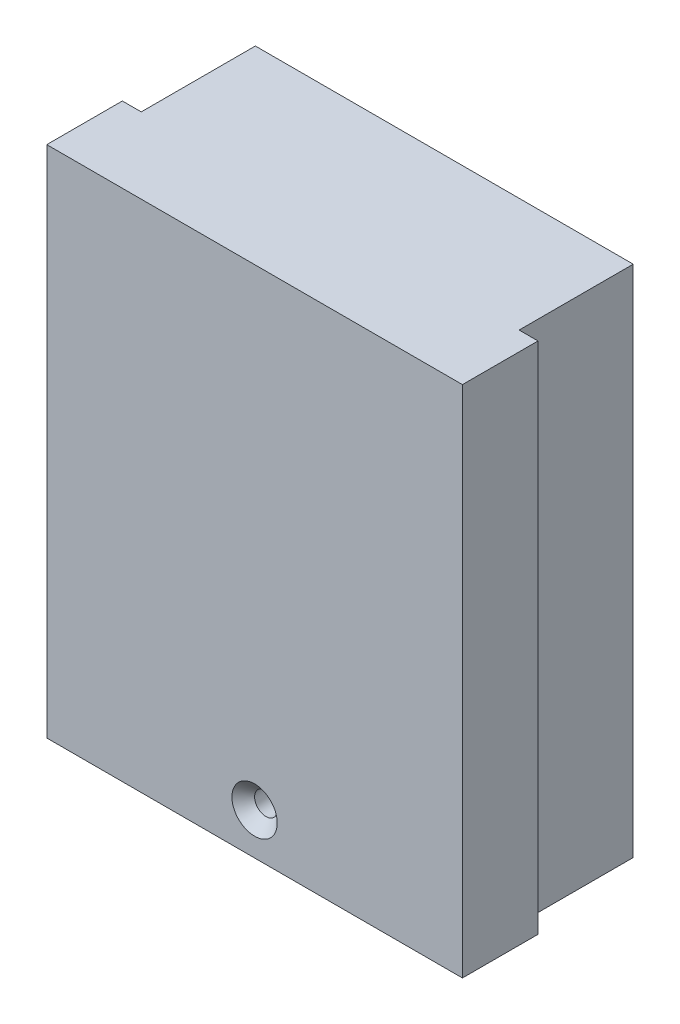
SolidWorks part; units mm, degrees
ref_plane "Plan de face" through (0, 0, 0) normal (0, 0, 1) x (1, 0, 0)
ref_plane "Plan de dessus" through (0, 0, 0) normal (0, 1, 0) x (1, 0, 0)
ref_plane "Plan de droite" through (0, 0, 0) normal (1, 0, 0) x (0, 0, -1)
sketch "Esquisse1" plane through (0, 0, 0) normal (0, 1, 0) x (1, 0, 0)
  line L0 (0, 0) -> (0, 25.1) construction
  line L1 (-25, 25.1) -> (25, 25.1)
  line L2 (-27.5, 10) -> (-27.5, 0)
  line L3 (-27.5, 0) -> (27.5, 0)
  line L4 (27.5, 10) -> (27.5, 0)
  line L8 (-27.5, 10) -> (-25, 10)
  line L9 (-25, 25.1) -> (-25, 10)
  line L12 (27.5, 10) -> (25, 10)
  line L13 (25, 25.1) -> (25, 10)
  dimension "D1" = 25.1
  dimension "D2" = 55
  dimension "D3" = 10
  dimension "D4" = 50
extrude "section profilé" add sketch "Esquisse1" along normal blind 68
ref_plane "Plan pour buse" through (0, 0, -1.5) normal (0, 0, 1) x (1, 0, 0)
sketch "Esquisse2" plane through (0, 0, -1.5) normal (0, 0, 1) x (1, 0, 0)
  line L0 (0, 0) -> (0, 68) construction
  line L1 (25, 68) -> (-25, 68) construction
  circle A0 centre (0, 30.5) radius 1.5
  dimension "D1" = 30.5
  dimension "D2" = 3
extrude "carotte centrale" [suppressed] cut sketch "Esquisse2" against normal through all draft 2
sketch "Esquisse3" [suppressed] plane through (0, 0, -23.6) normal (0, 0, 1) x (1, 0, 0)
  circle A1 centre (0, 30.5) radius 1.5
  circle A2 centre (0, 30.5) radius 1.5
  dimension "D1" = 0
extrude "cône d'appui buse" [suppressed] cut sketch "Esquisse3" against normal blind 68 draft 45
sketch "Esquisse4" plane through (0, 0, -1.5) normal (0, 0, 1) x (1, 0, 0)
  line L0 (0, 0) -> (0, 68) construction
  line L1 (25, 68) -> (-25, 68) construction
  line L3 (-27.5, 0) -> (27.5, 0) construction
  circle A0 centre (0, 5.5) radius 1.5
  dimension "D1" = 3
  dimension "D2" = 5.5
extrude "carotte basse" cut sketch "Esquisse4" against normal through all draft 2
sketch "Esquisse5" plane through (0, 0, -1.5) normal (0, 0, -1) x (-1, 0, 0)
  circle A1 centre (0, 5.5) radius 1.5
  circle A2 centre (0, 5.5) radius 1.5
  dimension "D1" = 0
extrude "cône d'appui buse basse" cut sketch "Esquisse5" against normal through all draft 45
